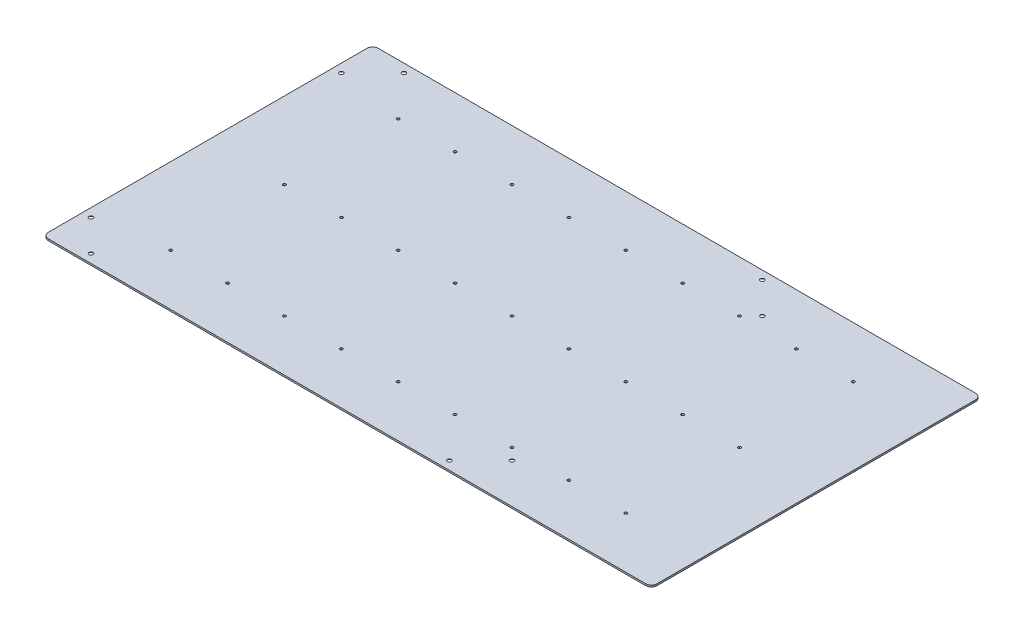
SolidWorks part; units mm, degrees
ref_plane "前视基准面" through (0, 0, 0) normal (0, 0, 1) x (1, 0, 0)
ref_plane "上视基准面" through (0, 0, 0) normal (0, 1, 0) x (1, 0, 0)
ref_plane "右视基准面" through (0, 0, 0) normal (1, 0, 0) x (0, 0, -1)
other "Configuration Table"
sketch "草图1" plane through (0, 0, 0) normal (0, 1, 0) x (1, 0, 0)
  line L1 (-535, 290) -> (535, 290)
  line L2 (-535, 290) -> (-535, -290)
  line L3 (-535, -290) -> (535, -290)
  line L4 (535, 290) -> (535, -290)
  line L5 (-535, 290) -> (535, -290) construction
  line L6 (-535, -290) -> (535, 290) construction
  point P0 (0, 0)
  point P6 (-465, -275)
  point P7 (165, 275)
  point P8 (165, -275)
  point P9 (-520, 220)
  point P10 (-520, -220)
  point P11 (220, -220)
  point P12 (-465, 275)
  point P13 (220, 220)
  point P14 (-400, -200)
  dimension "D15" = 370
  dimension "D1" = 15
  dimension "D2" = 70
  dimension "D3" = 370
  dimension "D4" = 15
  dimension "D5" = 70
  dimension "D6" = 15
  dimension "D7" = 70
  dimension "D8" = 15
  dimension "D9" = 15
  dimension "D10" = 70
  dimension "D11" = 315
  dimension "D12" = 315
  dimension "D13" = 90
  dimension "D14" = 135
  dimension "D16" = 70
  dimension "D17" = 70
  dimension "D18" = 15
extrude "凸台-拉伸1" add sketch "草图1" along normal blind 3
hole_wizard "M6 内六角花形半沉头螺钉的锥形沉头孔1" positions "草图4" profile "草图5" countersink size "M6" standard "GB"
sketch "草图4" plane through (0, 0, 0) normal (0, -1, 0) x (-1, 0, 0)
  point P0 (-165, 275)
  point P3 (-220, 220)
  point P6 (-220, -220)
  point P9 (-165, -275)
  point P12 (465, -275)
  point P15 (520, -220)
  point P18 (520, 220)
  point P21 (465, 275)
sketch "草图5" plane through (165, 0, -275) normal (1, 0, 0) x (0, 0, -1)
  line L0 (0, 0) -> (0, 3)
  line L1 (0, 3) -> (3.5, 3)
  line L2 (3.5, 3) -> (3.5, 2.9)
  line L3 (3.5, 2.9) -> (6.4, 0)
  line L5 (6.4, 0) -> (0, 0)
  line L6 (-3.5, 2.9) -> (-6.4, 0) construction
  line L11 (0, -6.35) -> (0, 107.95) construction
  dimension "通孔孔直径" = 7
  dimension "通孔孔深度" = 3
  dimension "近端锥形沉头孔直径" = 12.8
  dimension "近端锥形沉头孔角度" = 90
hole_wizard "M6 螺纹孔1" positions "草图6" profile "草图7" tap size "M6" standard "GB"
sketch "草图6" plane through (0, 3, 0) normal (0, 1, 0) x (1, 0, 0)
  point P0 (-400, -200)
sketch "草图7" plane through (-400, 3, 200) normal (1, 0, 0) x (0, 0, 1)
  line L0 (0, 0) -> (0, 3)
  line L1 (0, 3) -> (2.5, 3)
  line L2 (2.5, 3) -> (2.5, 0)
  line L5 (2.5, 0) -> (0, 0)
  line L11 (0, -6.35) -> (0, 107.95) construction
  dimension "通孔螺纹孔钻头直径" = 5
  dimension "通孔螺纹孔钻头深度" = 3
pattern_linear "阵列(线性)1" count 3 spacing 200 along (0, 0, -1) count 9 spacing 100 along (1, 0, 0) of "M6 螺纹孔1"
fillet "圆角1" radius 10 4 edges at (-535, 1.5, -290) (535, 1.5, -290) (-535, 1.5, 290) (535, 1.5, 290)
